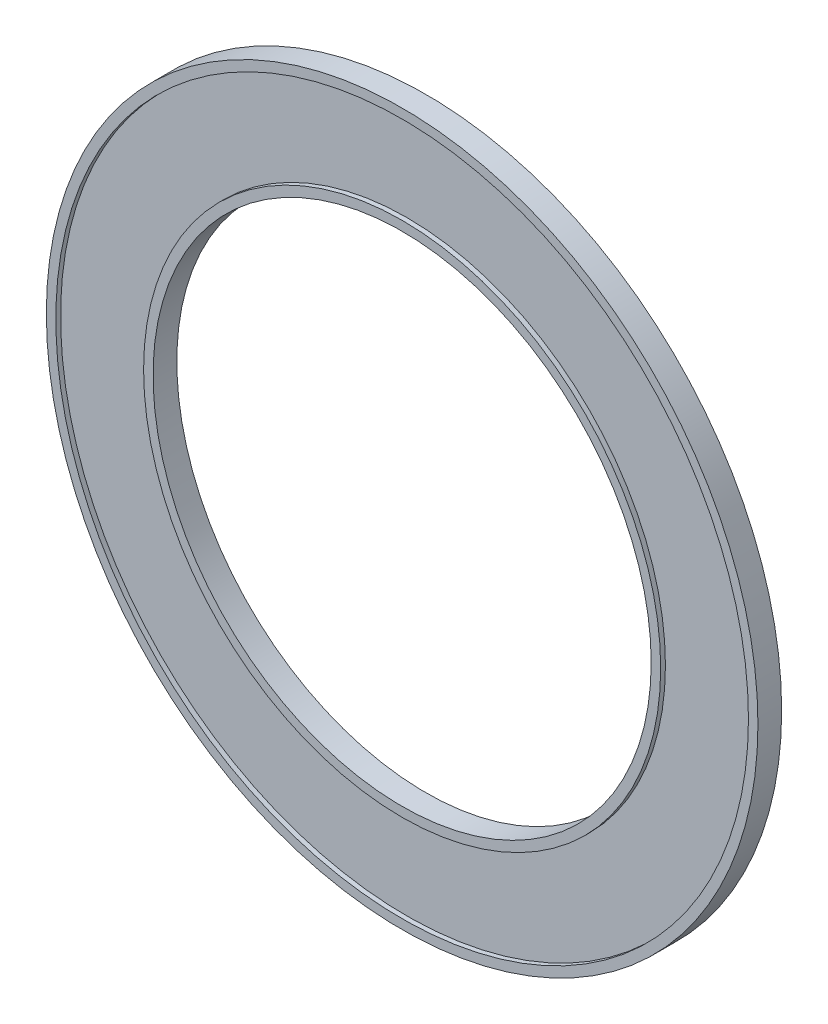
SolidWorks part; units mm, degrees
ref_plane "Front Plane" through (0, 0, 0) normal (0, 0, 1) x (1, 0, 0)
ref_plane "Top Plane" through (0, 0, 0) normal (0, 1, 0) x (1, 0, 0)
ref_plane "Right Plane" through (0, 0, 0) normal (1, 0, 0) x (0, 0, -1)
sketch "Sketch1" plane through (0, 0, 0) normal (0, 0, 1) x (1, 0, 0)
  circle A0 centre (0, 0) radius 150
  circle A1 centre (0, 0) radius 105
  dimension "D1" = 300
  dimension "D2" = 210
extrude "Boss-Extrude1" add sketch "Sketch1" along normal blind 10
sketch "Sketch2" plane through (0, 0, 10) normal (0, 0, 1) x (1, 0, 0)
  circle A2 centre (0, 0) radius 146
  circle A3 centre (0, 0) radius 146
  circle A5 centre (0, 0) radius 109
  circle A6 centre (0, 0) radius 109
  dimension "D1" = 4
  dimension "D2" = 4
extrude "Cut-Extrude1" cut sketch "Sketch2" against normal blind 2 contours A3 A6
sketch "Sketch3" plane through (0, 0, 0) normal (0, 0, -1) x (-1, 0, 0)
  circle A0 centre (0, 126) radius 5
  circle A1 centre (0, -126) radius 5
  dimension "D1" = 10
  dimension "D2" = 10
  dimension "D3" = 252
  dimension "D4" = 126
extrude "Cut-Extrude2" cut sketch "Sketch3" against normal blind 6
